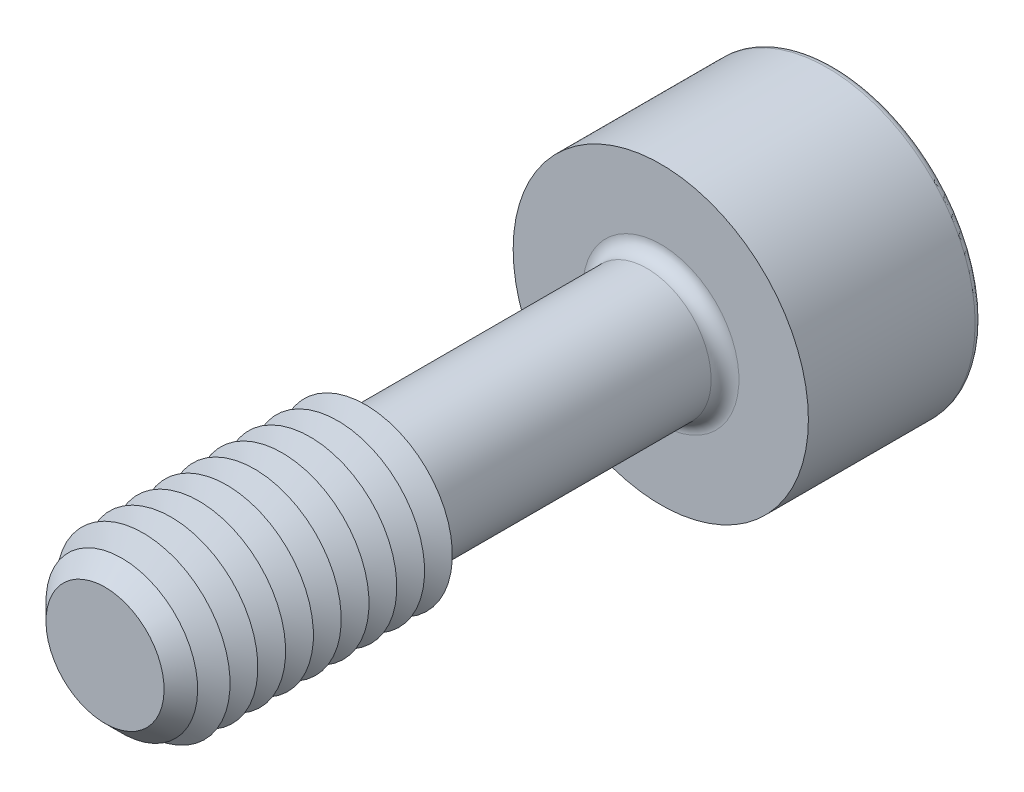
SolidWorks part; units mm, degrees
ref_plane "Front Plane" through (0, 0, 0) normal (0, 0, 1) x (1, 0, 0)
ref_plane "Top Plane" through (0, 0, 0) normal (0, 1, 0) x (1, 0, 0)
ref_plane "Right Plane" through (0, 0, 0) normal (1, 0, 0) x (0, 0, -1)
sketch "Sketch1" plane through (0, 0, 0) normal (0, 0, 1) x (1, 0, 0)
  circle A0 centre (0, 0) radius 1.85
  dimension "D1" = 3.7
extrude "Extrude1" add sketch "Sketch1" along normal mid plane 16
sketch "Sketch2" plane through (0, 0, 0) normal (1, 0, 0) x (0, 0, -1)
  line L0 (-8, 0) -> (-8, 2.5)
  line L1 (-8, 1.85) -> (-8, -1.85) construction
  line L2 (-8, 2.5) -> (-0.5, 2.5)
  line L3 (-0.5, 2.5) -> (-0.1247, 1.85)
  line L4 (8, 1.85) -> (-8, 1.85) construction
  line L5 (-0.1247, 1.85) -> (-0.1247, 0)
  line L6 (-0.1247, 0) -> (-8, 0)
  dimension "D1" = 2.5
  dimension "D2" = 120
  dimension "D3" = 7.5
revolve "Revolve1" add sketch "Sketch2" angle 360 about L6
chamfer "Chamfer1" distance 0.8 angle 45 1 edges at (0, 2.5, 8)
sketch "Sketch3" plane through (0, 0, -8) normal (0, 0, -1) x (-1, 0, 0)
  circle A0 centre (0, 0) radius 4.25
  dimension "D1" = 8.5
extrude "Extrude2" add sketch "Sketch3" along normal blind 5
sketch "Sketch4" plane through (-13.7, 0, -13) normal (0, 0, 1) x (1, 0, 0)
  line L2 (12.5453, -2) -> (14.8547, -2)
  line L3 (14.8547, -2) -> (16.0094, 0)
  line L4 (16.0094, 0) -> (14.8547, 2)
  line L6 (14.8547, 2) -> (12.5453, 2)
  line L7 (12.5453, 2) -> (11.3906, 0)
  line L8 (11.3906, 0) -> (12.5453, -2)
  circle A0 centre (13.7, 0) radius 2 construction
  dimension "D1" = 4
extrude "Extrude3" cut sketch "Sketch4" along normal blind 4
fillet "Fillet1" radius 0.4 1 edges at (-1.85, 0, -8)
fillet "Fillet2" radius 0.2 1 edges at (-4.25, 0, -13)
sketch "Sketch5" plane through (0, 0, 0) normal (1, 0, 0) x (0, 0, -1)
  line L0 (9, 0) -> (9, -2)
  line L1 (9, -2) -> (7.8453, 0)
  line L2 (7.8453, 0) -> (9, 0)
  dimension "D1" = 30
revolve "Cut-Revolve1" cut sketch "Sketch5" angle 360 about L2
sketch "Sketch6" plane through (0, 0, 0) normal (1, 0, 0) x (0, 0, -1)
  line L0 (1.332, 0) -> (-13.289, 0) construction
sketch "Sketch7" plane through (0, 0, 0) normal (1, 0, 0) x (0, 0, -1)
  line L0 (-0.5, 2.5) -> (-0.9, 1.8072)
  line L1 (-0.9, 1.8072) -> (-1.3, 2.5)
  line L2 (-0.5, 2.5) -> (-7.2, 2.5) construction
  line L3 (-1.3, 2.5) -> (-0.5, 2.5)
  dimension "D1" = 0.8
revolve "Cut-Revolve2" cut sketch "Sketch7" angle 360 about L0
pattern_linear "LPattern1" count 9 spacing 0.8 along (0, 0, 1) of "Cut-Revolve2"
